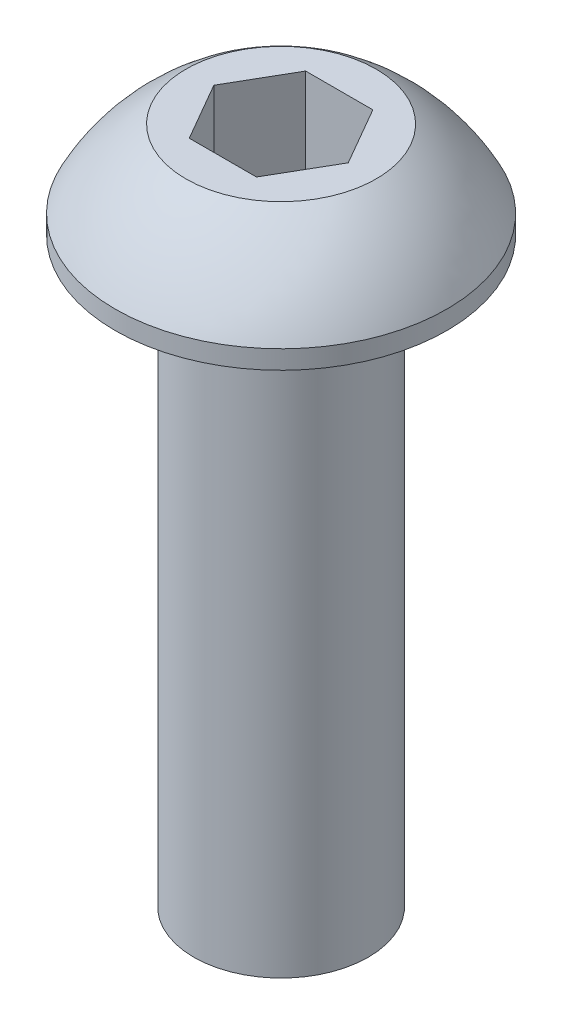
SolidWorks part; units mm, degrees
ref_plane "Front" through (0, 0, 0) normal (0, 0, 1) x (1, 0, 0)
ref_plane "Top" through (0, 0, 0) normal (0, 1, 0) x (1, 0, 0)
ref_plane "Right" through (0, 0, 0) normal (1, 0, 0) x (0, 0, -1)
sketch "profiile" plane through (0, 0, 0) normal (0, 0, 1) x (1, 0, 0)
  line L0 (0, 9.9072) -> (0, -20.7151) construction
  line L1 (0, 1.65) -> (1.635, 1.65)
  line L2 (2.85, 0.3202) -> (2.85, 0)
  line L3 (2.85, 0) -> (1.5, 0)
  line L4 (1.5, 0) -> (1.5, -10)
  line L5 (1.5, -10) -> (0, -10)
  line L6 (0, -10) -> (0, 1.65)
  arc A0 (1.635, 1.65) -> (2.85, 0.3202) centre (-0.1518, -1.2026) cw
  dimension "D1" = 5.7
  dimension "D2" = 1.65
  dimension "thread_length" = 10
  dimension "D4" = 3
revolve "Base-Revolve" add sketch "profiile" angle 360 about L0
sketch "Sketch1" plane through (0, 1.65, 0) normal (0, 1, 0) x (-1, 0, 0)
  line L0 (0, 0) -> (1.1547, 0) construction
  line L1 (0, 0) -> (0.5774, 1) construction
  line L2 (1.1547, 0) -> (0.5774, 1)
  line L3 (1.1547, 0) -> (0.5774, -1)
  line L4 (-0.5774, -1) -> (0.5774, -1)
  line L5 (-0.5774, -1) -> (-1.1547, 0)
  line L6 (-0.5774, 1) -> (-1.1547, 0)
  line L7 (-0.5774, 1) -> (0.5774, 1)
  dimension "D1" = 60
  dimension "D2" = 2
extrude "Cut-Extrude1" cut sketch "Sketch1" against normal blind 1.524
